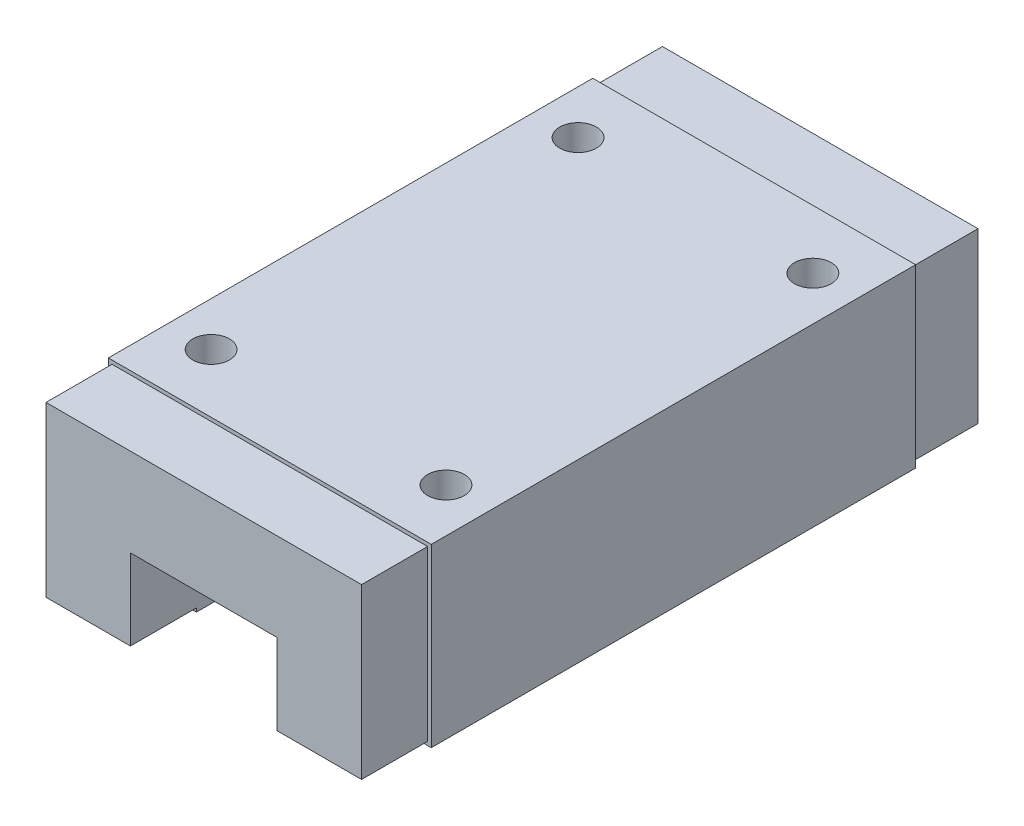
SolidWorks part; units mm, degrees
ref_plane "Ebene vorne" through (0, 0, 0) normal (0, 0, 1) x (1, 0, 0)
ref_plane "Ebene oben" through (0, 0, 0) normal (0, 1, 0) x (1, 0, 0)
ref_plane "Ebene rechts" through (0, 0, 0) normal (1, 0, 0) x (0, 0, -1)
sketch "Skizze1" plane through (0, 0, 0) normal (0, 1, 0) x (1, 0, 0)
  line L0 (22, 33) -> (-22, -33) construction
  line L1 (-22, 33) -> (22, 33)
  line L2 (-22, 33) -> (-22, -33)
  line L3 (-22, -33) -> (22, -33)
  line L4 (22, 33) -> (22, -33)
  dimension "D1" = 44
  dimension "D2" = 66
extrude "Linear austragen1" add sketch "Skizze1" along normal mid plane 24
sketch "Skizze2" plane through (0, 0, 33) normal (0, 0, 1) x (1, 0, 0)
  line L0 (21.5, 11.5) -> (-21.5, -11.5) construction
  line L1 (-21.5, 11.5) -> (21.5, 11.5)
  line L2 (-21.5, 11.5) -> (-21.5, -11.5)
  line L3 (-21.5, -11.5) -> (21.5, -11.5)
  line L4 (21.5, 11.5) -> (21.5, -11.5)
  dimension "D1" = 43
  dimension "D2" = 23
extrude "Linear austragen2" add sketch "Skizze2" along normal blind 9
sketch "Skizze3" plane through (0, 0, -33) normal (0, 0, -1) x (-1, 0, 0)
  line L0 (21.5, 11.5) -> (-21.5, -11.5) construction
  line L1 (21.5, 11.5) -> (-21.5, 11.5)
  line L2 (21.5, 11.5) -> (21.5, -11.5)
  line L3 (21.5, -11.5) -> (-21.5, -11.5)
  line L4 (-21.5, 11.5) -> (-21.5, -11.5)
  dimension "D1" = 43
  dimension "D2" = 23
extrude "Linear austragen3" add sketch "Skizze3" along normal blind 9
sketch "Skizze5" plane through (0, 0, 42) normal (0, 0, 1) x (1, 0, 0)
  line L0 (-22, -12) -> (22, -12) construction
  line L1 (-10, -0.5) -> (10, -0.5)
  line L2 (-10, -0.5) -> (-10, -12)
  line L3 (-10, -12) -> (10, -12)
  line L4 (10, -0.5) -> (10, -12)
  line L5 (10, -0.5) -> (-10, -12) construction
  line L6 (0, 0) -> (0, 12) construction
  line L7 (-22, 12) -> (22, 12) construction
  dimension "D1" = 20
  dimension "D2" = 11.5
extrude "Schnitt-Linear austragen1" cut sketch "Skizze5" against normal up to next
hole_wizard "M5x0.8 Gewindebohrung1" positions "Skizze7" profile "Skizze8" tap size "M5x0.8" standard "Ansi Metrisch"
sketch "Skizze7" plane through (0, 12, 0) normal (0, 1, 0) x (-1, 0, 0)
  line L0 (0, 33) -> (0, 0) construction
  line L1 (22, 33) -> (-22, 33) construction
  line L2 (0, 0) -> (-22, 0) construction
  line L3 (-22, 33) -> (-22, -33) construction
  point P0 (16, -25)
  point P1 (-16, -25)
  point P3 (-16, 25)
  point P5 (16, 25)
  dimension "D1" = 32
  dimension "D2" = 50
sketch "Skizze8" plane through (-16, 12, -25) normal (1, 0, 0) x (0, 0, 1)
  line L0 (0, 0) -> (0, 13.2618)
  line L1 (0, 13.2618) -> (2.1, 12)
  line L2 (2.1, 12) -> (2.1, 10)
  line L3 (2.1, 10) -> (2.5, 10)
  line L4 (2.5, 10) -> (2.5, 0)
  line L5 (2.5, 0) -> (0, 0)
  line L10 (0, 13.2618) -> (-2.1, 12) construction
  line L11 (0, -6.35) -> (0, 107.95) construction
  dimension "Bohrerdurchmesser" = 4.2
  dimension "Bohrungstiefe" = 12
  dimension "Nenndurchmesser" = 5
  dimension "Gewindelänge" = 10
  dimension "Spitzenwinkel" = 118
